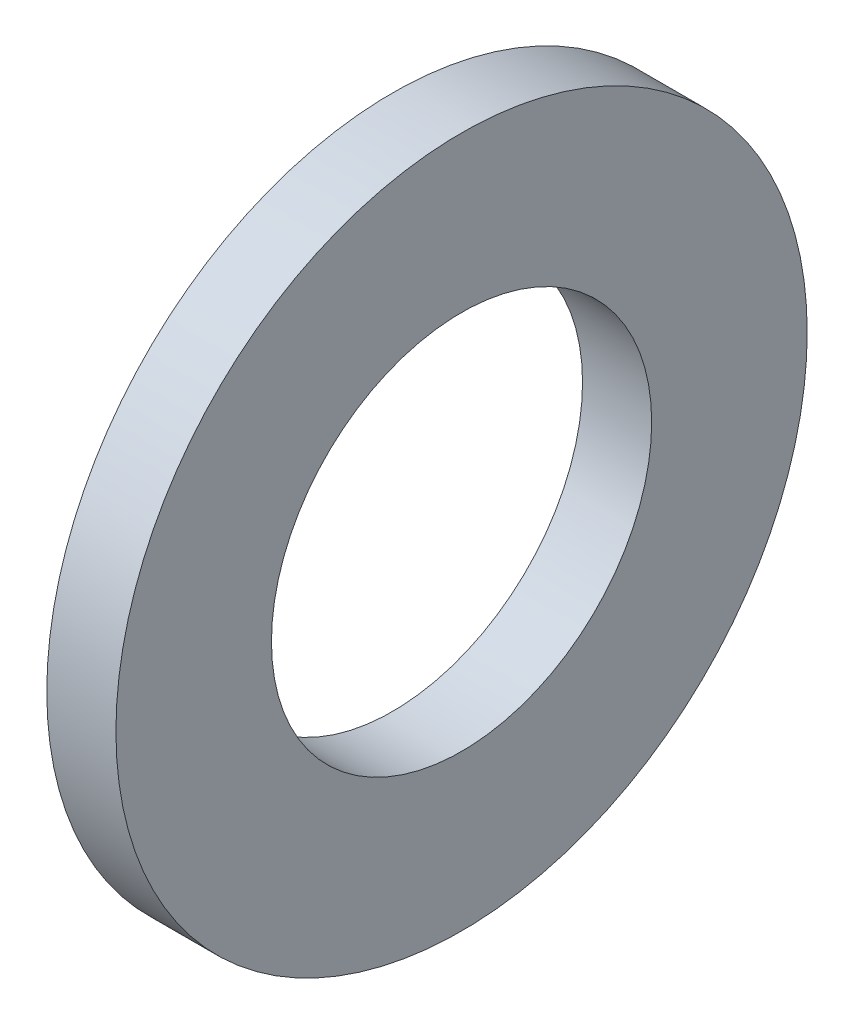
SolidWorks part; units mm, degrees
ref_plane "Plane1" through (0, 0, 0) normal (0, 0, 1) x (1, 0, 0)
ref_plane "Plane2" through (0, 0, 0) normal (0, 1, 0) x (1, 0, 0)
ref_plane "Plane3" through (0, 0, 0) normal (1, 0, 0) x (0, 0, -1)
sketch "Sketch1" plane through (0, 0, 0) normal (0, 0, 1) x (1, 0, 0)
  line L0 (-34.925, 0) -> (9.525, 0) construction
  line L1 (0, 5.5) -> (0, 10)
  line L2 (0, 10) -> (-2, 10)
  line L3 (-2, 10) -> (-2, 5.5)
  line L4 (-2, 5.5) -> (0, 5.5)
  dimension "Thickness" = 2
  dimension "Inside_dia" = 11
  dimension "Outside_dia" = 20
revolve "Base-Revolve" add sketch "Sketch1" angle 360 about L0
